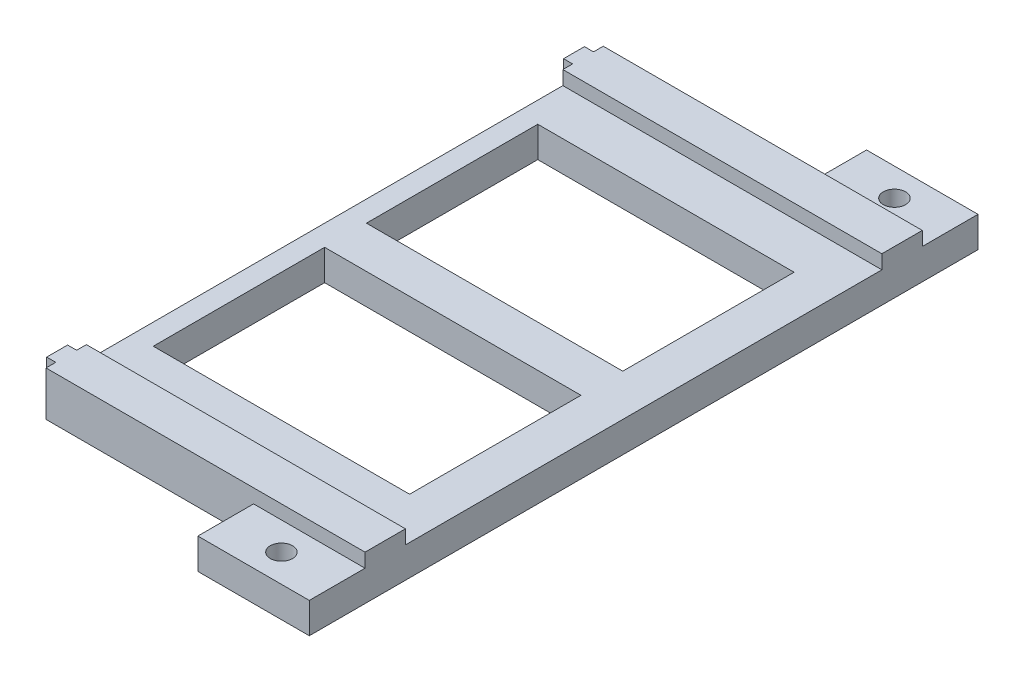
SolidWorks part; units mm, degrees
ref_plane "Front Plane" through (0, 0, 0) normal (0, 0, 1) x (1, 0, 0)
ref_plane "Top Plane" through (0, 0, 0) normal (0, 1, 0) x (1, 0, 0)
ref_plane "Right Plane" through (0, 0, 0) normal (1, 0, 0) x (0, 0, -1)
sketch "Sketch1" plane through (0, 0, 0) normal (0, 1, 0) x (1, 0, 0)
  line L1 (-184.5, -100) -> (184.5, -100)
  line L2 (-184.5, -100) -> (-184.5, 100)
  line L3 (-184.5, 100) -> (184.5, 100)
  line L4 (184.5, -100) -> (184.5, 100)
  line L5 (-184.5, -100) -> (184.5, 100) construction
  line L6 (-184.5, 100) -> (184.5, -100) construction
  point P0 (0, 0)
  dimension "D1" = 200
  dimension "353" = 369
extrude "Boss-Extrude1" add sketch "Sketch1" along normal blind 16
sketch "Sketch2" plane through (0, 16, 0) normal (0, 1, 0) x (1, 0, 0)
  line L0 (-184.5, -100) -> (184.5, -100) construction
  line L1 (-184.5, -100) -> (-155.6166, -100)
  line L2 (-184.5, -100) -> (-184.5, -36.5)
  line L3 (-184.5, -36.5) -> (-169.5, -36.5)
  line L4 (-169.5, -84) -> (-169.5, -36.5)
  line L5 (-184.5, 100) -> (-155.6166, 100)
  line L6 (-184.5, 100) -> (-184.5, 36.5)
  line L7 (-184.5, 36.5) -> (-169.5, 36.5)
  line L8 (-169.5, 84) -> (-169.5, 36.5)
  line L9 (-155.6166, 100) -> (-119.5, 100)
  line L11 (-169.5, 84) -> (-119.5, 84)
  line L12 (-119.5, 100) -> (-119.5, 84)
  line L13 (-155.6166, -100) -> (-119.5, -100)
  line L15 (-169.5, -84) -> (-119.5, -84)
  line L16 (-119.5, -100) -> (-119.5, -84)
  line L17 (-44.5, -100) -> (84.5, -100)
  line L18 (-44.5, -100) -> (-44.5, -84)
  line L19 (-44.5, -84) -> (84.5, -84)
  line L20 (84.5, -100) -> (84.5, -84)
  line L22 (-44.5, 100) -> (84.5, 100)
  line L23 (-44.5, 100) -> (-44.5, 84)
  line L24 (-44.5, 84) -> (84.5, 84)
  line L25 (84.5, 100) -> (84.5, 84)
  line L26 (184.5, -100) -> (184.5, 100) construction
  line L27 (184.5, 100) -> (-184.5, 100) construction
  point P28 (84.5, -92)
  dimension "D1" = 65
  dimension "D2" = 15
  dimension "D3" = 65
  dimension "D4" = 15
  dimension "D5" = 16
  dimension "D6" = 50
  dimension "D7" = 50
  dimension "D8" = 16
  dimension "D9" = 75
  dimension "D10" = 100
extrude "Boss-Extrude2" add sketch "Sketch2" along normal blind 12
sketch "Sketch3" plane through (0, 16, 0) normal (0, 1, 0) x (1, 0, 0)
  line L0 (-119.5, -84) -> (-169.5, -84) construction
  line L1 (-169.5, 84) -> (172.5, 84)
  line L2 (-169.5, 84) -> (-169.5, -84)
  line L3 (-169.5, -84) -> (172.5, -84)
  line L4 (172.5, 84) -> (172.5, -84)
  dimension "D1" = 342
extrude "Cut-Extrude1" cut sketch "Sketch3" against normal blind 5
sketch "Sketch4" plane through (0, 0, -100) normal (0, 0, -1) x (-1, 0, 0)
  line L0 (-84.5, 28) -> (44.5, 28) construction
  line L1 (-69.5, 16) -> (30.5, 16)
  line L2 (-69.5, 16) -> (-69.5, 28)
  line L3 (-69.5, 28) -> (30.5, 28)
  line L4 (30.5, 16) -> (30.5, 28)
  line L5 (-69.5, 16) -> (30.5, 28) construction
  line L6 (-69.5, 28) -> (30.5, 16) construction
  line L8 (-84.5, 28) -> (-84.5, 16) construction
  point P0 (-19.5, 22)
  dimension "D1" = 100
  dimension "D2" = 15
extrude "Boss-Extrude3" add sketch "Sketch4" along normal blind 60
sketch "Sketch8" plane through (0, 28, 0) normal (0, 1, 0) x (1, 0, 0)
  line L0 (-184.5, 36.5) -> (-169.5, 36.5)
  line L1 (-169.5, 36.5) -> (-169.5, 84)
  line L2 (-169.5, 84) -> (-119.5, 84)
  line L3 (-119.5, 84) -> (-119.5, 100)
  line L4 (-119.5, 100) -> (-184.5, 100)
  line L5 (-184.5, 100) -> (-184.5, 36.5)
extrude "Boss-Extrude5" add sketch "Sketch8" along normal blind 42
sketch "Sketch9" plane through (0, 70, 0) normal (0, 1, 0) x (1, 0, 0)
  line L0 (-119.5, 84) -> (-119.5, 70)
  line L1 (-119.5, 70) -> (-155.5, 70)
  line L2 (-155.5, 70) -> (-155.5, 35)
  line L3 (-155.5, 35) -> (-169.5, 35)
  line L4 (-169.5, 36.5) -> (-169.5, 84) construction
  line L5 (-169.5, 84) -> (-169.5, -84) construction
  line L6 (172.5, 84) -> (-169.5, 84) construction
  dimension "D1" = 14
  dimension "D2" = 14
extrude "Extrude-Thin1" add sketch "Sketch9" against normal blind 7 thin
sketch "Sketch11" plane through (0, 70, 0) normal (0, 1, 0) x (1, 0, 0)
  line L1 (-184.5, 100) -> (-44.5, 100)
  line L2 (-184.5, 100) -> (-184.5, -100)
  line L3 (-184.5, -100) -> (-44.5, -100)
  line L4 (-44.5, 100) -> (-44.5, -100)
extrude "Cut-Extrude5" cut sketch "Sketch11" against normal through all
sketch "Sketch13" plane through (0, 28, 0) normal (0, 1, 0) x (1, 0, 0)
  line L0 (-44.5, 96.22) -> (-44.5, 87.78)
  line L1 (-44.5, 100) -> (-44.5, 84) construction
  line L2 (-44.5, 87.78) -> (-52.3, 86.4046)
  line L3 (-52.3, 86.4046) -> (-52.3, 97.5954)
  line L4 (-52.3, 97.5954) -> (-44.5, 96.22)
  line L5 (-44.5, -87.78) -> (-44.5, -96.22)
  line L6 (-44.5, -96.22) -> (-52.5, -97.6306)
  line L7 (-52.5, -97.6306) -> (-52.5, -86.3694)
  line L8 (-52.5, -86.3694) -> (-44.5, -87.78)
  line L9 (-44.5, -84) -> (-44.5, -100) construction
  dimension "D1" = 3.78
  dimension "D2" = 3.78
  dimension "D3" = 7.8
  dimension "D4" = 80
  dimension "D5" = 80
  dimension "D6" = 3.78
  dimension "D7" = 3.78
  dimension "D8" = 80
  dimension "D9" = 8
  dimension "D10" = 80
extrude "Boss-Extrude6" add sketch "Sketch13" against normal through all
fillet "Fillet1" radius 1.5 8 edges at (-44.5, 14, 87.78) (-52.5, 14, 86.3694) (-52.5, 14, 97.6306) (-44.5, 14, 96.22) (-44.5, 14, -96.22) (-44.5, 14, -87.78) (-52.3, 14, -86.4046) (-52.3, 14, -97.5954)
sketch "Sketch14" plane through (0, 0, 0) normal (0, 0, 1) x (1, 0, 0)
  line L0 (84.5, 16) -> (184.5, 16) construction
  line L1 (84.5, 28) -> (-67.1004, 28)
  line L2 (84.5, 28) -> (84.5, 16)
  line L3 (84.5, 16) -> (-67.1004, 16)
  line L4 (-67.1004, 28) -> (-67.1004, 16)
extrude "Cut-Extrude6" cut sketch "Sketch14" along normal through all and the other way through all
sketch "Sketch15" plane through (0, 16, 0) normal (0, 1, 0) x (1, 0, 0)
  line L0 (184.5, 100) -> (-44.5, 100) construction
  line L1 (-17.9669, 100) -> (79.8991, 100)
  line L2 (-17.9669, 100) -> (-17.9669, 84)
  line L3 (-17.9669, 84) -> (79.8991, 84)
  line L4 (79.8991, 100) -> (79.8991, 84)
  line L5 (172.5, 84) -> (-44.5, 84) construction
extrude "Boss-Extrude7" add sketch "Sketch15" along normal blind 62
sketch "Sketch16" plane through (0, 0, -84) normal (0, 0, 1) x (1, 0, 0)
  line L0 (79.8991, 78) -> (79.8991, 16) construction
  line L1 (-17.9669, 78) -> (79.8991, 78)
  line L2 (-17.9669, 78) -> (-17.9669, 65)
  line L3 (-17.9669, 65) -> (79.8991, 65)
  line L4 (79.8991, 78) -> (79.8991, 65)
  line L5 (172.5, 11) -> (-44.5, 11) construction
  dimension "D1" = 54
extrude "Boss-Extrude8" add sketch "Sketch16" along normal blind 20
sketch "Sketch17" plane through (0, 65, 0) normal (0, -1, 0) x (1, 0, 0)
  line L0 (-17.9669, -64) -> (-17.9669, -84) construction
  line L1 (-17.9669, -71.2) -> (79.8991, -71.2)
  line L2 (-17.9669, -71.2) -> (-17.9669, -76.85)
  line L3 (-17.9669, -76.85) -> (79.8991, -76.85)
  line L4 (79.8991, -71.2) -> (79.8991, -76.85)
  line L5 (79.8991, -64) -> (79.8991, -84) construction
  line L6 (-17.9669, -84) -> (79.8991, -84) construction
  dimension "D1" = 5.65
  dimension "D2" = 7.15
extrude "Boss-Extrude9" add sketch "Sketch17" along normal blind 5
fillet "Fillet3" radius 1 2 edges at (30.9661, 60, -76.85) (30.9661, 60, -71.2)
sketch "Sketch18" plane through (0, 16, 0) normal (0, 1, 0) x (1, 0, 0)
  line L0 (184.5, -100) -> (184.5, 100) construction
  line L1 (172.5, 84) -> (184.5, 84)
  line L2 (172.5, 84) -> (172.5, -84)
  line L3 (172.5, -84) -> (184.5, -84)
  line L4 (184.5, 84) -> (184.5, -84)
  line L5 (-44.5, -84) -> (172.5, -84) construction
extrude "Cut-Extrude7" cut sketch "Sketch18" against normal blind 5
sketch "Sketch19" plane through (0, 0, -100) normal (0, 0, -1) x (-1, 0, 0)
  line L1 (0, 0) -> (-40, 0)
  line L2 (0, 0) -> (0, 11)
  line L3 (0, 11) -> (-40, 11)
  line L4 (-40, 0) -> (-40, 11)
  line L5 (-184.5, 0) -> (-144.5, 0)
  line L6 (-184.5, 0) -> (-184.5, 11)
  line L7 (-184.5, 11) -> (-144.5, 11)
  line L8 (-144.5, 0) -> (-144.5, 11)
  dimension "D1" = 11
  dimension "D2" = 11
  dimension "D3" = 40
  dimension "D4" = 40
extrude "Boss-Extrude10" add sketch "Sketch19" along normal blind 20
sketch "Sketch20" plane through (0, 11, 0) normal (0, 1, 0) x (1, 0, 0)
  line L0 (40, 120) -> (40, 100) construction
  line L1 (0, 120) -> (40, 120) construction
  line L2 (144.5, 120) -> (184.5, 120) construction
  line L3 (184.5, 120) -> (184.5, 100) construction
  circle A0 centre (164.5, 110) radius 4
  circle A1 centre (20, 110) radius 4
  dimension "D1" = 20
  dimension "D2" = 10
  dimension "D3" = 10
  dimension "D4" = 20
extrude "Cut-Extrude8" cut sketch "Sketch20" against normal through all
mirror "Mirror3" about plane through (0, 0, 0) normal (0, 0, 1) of "Cut-Extrude8", "Boss-Extrude10", "Boss-Extrude9", "Boss-Extrude7", "Boss-Extrude8", "Fillet3"
sketch "Sketch21" plane through (0, 11, 0) normal (0, 1, 0) x (1, 0, 0)
  line L1 (-29.5, 7.5) -> (62.5, 7.5)
  line L2 (-29.5, 7.5) -> (-29.5, 69)
  line L3 (-29.5, 69) -> (62.5, 69)
  line L4 (62.5, 7.5) -> (62.5, 69)
  line L5 (77.5, 69) -> (169.5, 69)
  line L6 (77.5, 69) -> (77.5, 7.5)
  line L7 (77.5, 7.5) -> (169.5, 7.5)
  line L8 (169.5, 69) -> (169.5, 7.5)
  line L9 (-44.5, -84) -> (-44.5, 84) construction
  line L10 (62.5, -7.5) -> (-29.5, -7.5)
  line L11 (62.5, -7.5) -> (62.5, -69)
  line L12 (62.5, -69) -> (-29.5, -69)
  line L13 (-29.5, -7.5) -> (-29.5, -69)
  line L14 (77.5, -7.5) -> (169.5, -7.5)
  line L15 (77.5, -7.5) -> (77.5, -69)
  line L16 (77.5, -69) -> (169.5, -69)
  line L17 (169.5, -7.5) -> (169.5, -69)
  line L18 (184.5, -84) -> (184.5, 84) construction
  line L19 (-44.5, -84) -> (184.5, -84) construction
  line L20 (184.5, 84) -> (79.8991, 84) construction
  line L21 (-17.9669, 84) -> (-44.5, 84) construction
  line L22 (-55, 0) -> (55, 0) construction
  dimension "D1" = 15
  dimension "D2" = 15
  dimension "D3" = 15
  dimension "D4" = 15
  dimension "D5" = 15
  dimension "D6" = 15
  dimension "D7" = 15
  dimension "D8" = 15
  dimension "D9" = 7.5
  dimension "D10" = 7.5
  dimension "D11" = 7.5
  dimension "D12" = 7.5
  dimension "D13" = 122
  dimension "D14" = 15
extrude "Cut-Extrude9" cut sketch "Sketch21" against normal through all
sketch "Sketch22" plane through (79.8991, 0, 0) normal (1, 0, 0) x (0, 0, -1)
  line L0 (-84, 11) -> (84, 11) construction
  line L1 (-84, 65) -> (-85.5, 65)
  line L2 (-84, 65) -> (-84, 11)
  line L3 (-84, 11) -> (-85.5, 11)
  line L4 (-85.5, 65) -> (-85.5, 11)
  dimension "D1" = 1.5
extrude "Cut-Extrude10" cut sketch "Sketch22" against normal through all both and the other way through all
mirror "Mirror4" about plane through (0, 0, 0) normal (0, 0, 1) of "Cut-Extrude10"
sketch "Sketch23" plane through (0, 78, 0) normal (0, 1, 0) x (1, 0, 0)
  line L0 (79.8991, -100) -> (-17.9669, -100) construction
  line L1 (79.8991, -64) -> (66.6759, -64)
  line L2 (79.8991, -64) -> (79.8991, -100)
  line L3 (79.8991, -100) -> (66.6759, -100)
  line L4 (66.6759, -64) -> (66.6759, -100)
extrude "Cut-Extrude11" cut sketch "Sketch23" against normal up to surface (62 mm away)
mirror "Mirror5" about plane through (0, 0, 0) normal (0, 0, 1) of "Cut-Extrude11"
sketch "Sketch24" plane through (0, 78, 0) normal (0, 1, 0) x (1, 0, 0)
  line L0 (77.5, 69) -> (77.5, 7.5) construction
  line L1 (-52.5, -122.0217) -> (70, -122.0217)
  line L2 (-52.5, -122.0217) -> (-52.5, 123.3832)
  line L3 (-52.5, 123.3832) -> (70, 123.3832)
  line L4 (70, -122.0217) -> (70, 123.3832)
  line L5 (-52.5, -95.843) -> (-52.5, -88.157) construction
  dimension "D1" = 7.5
extrude "Cut-Extrude12" cut sketch "Sketch24" against normal through all and the other way through all
sketch "Sketch25" plane through (0, 16, 0) normal (0, 1, 0) x (1, 0, 0)
  line L0 (70, -85.5) -> (70, -100) construction
  line L1 (70, -89) -> (66.75, -89)
  line L2 (70, -89) -> (70, -96.5)
  line L3 (70, -96.5) -> (66.75, -96.5)
  line L4 (66.75, -89) -> (66.75, -96.5)
  line L5 (70, -85.5) -> (184.5, -85.5) construction
  dimension "D1" = 7.5
  dimension "D2" = 3.5
  dimension "D3" = 3.25
extrude "Boss-Extrude11" add sketch "Sketch25" against normal up to surface (16 mm away)
mirror "Mirror6" about plane through (0, 0, 0) normal (0, 0, 1) of "Boss-Extrude11"
equation "\"´7.25\"=7.35"
